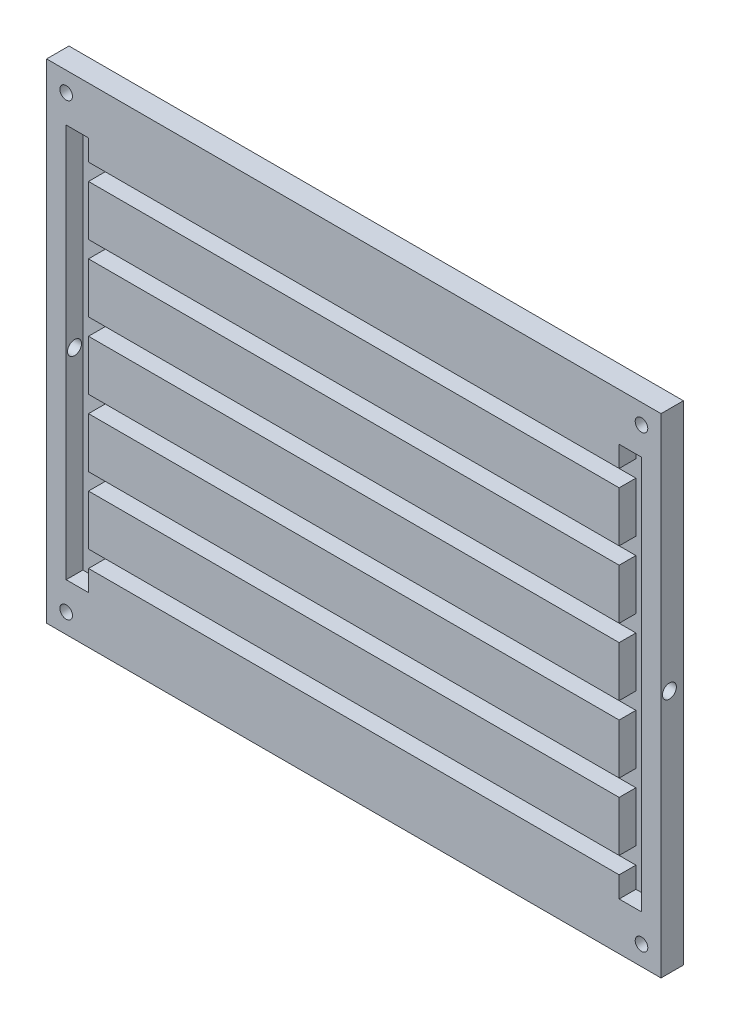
SolidWorks part; units mm, degrees
ref_plane "Front Plane" through (0, 0, 0) normal (0, 0, 1) x (1, 0, 0)
ref_plane "Top Plane" through (0, 0, 0) normal (0, 1, 0) x (1, 0, 0)
ref_plane "Right Plane" through (0, 0, 0) normal (1, 0, 0) x (0, 0, -1)
sketch "Sketch1" plane through (0, 0, 0) normal (0, 0, 1) x (1, 0, 0)
  line L1 (0, 0) -> (220, 0)
  line L2 (0, 0) -> (0, 175)
  line L3 (0, 175) -> (220, 175)
  line L4 (220, 0) -> (220, 175)
  dimension "D1" = 220
  dimension "D2" = 175
extrude "Boss-Extrude1" add sketch "Sketch1" along normal blind 8
sketch "Sketch2" plane through (0, 0, 8) normal (0, 0, 1) x (1, 0, 0)
  line L0 (15, 54.5) -> (15, 48.5)
  line L1 (15, 30.5) -> (205, 30.5)
  line L2 (15, 30.5) -> (15, 24.5)
  line L3 (15, 24.5) -> (205, 24.5)
  line L4 (205, 30.5) -> (205, 24.5)
  line L5 (15, 54.5) -> (205, 54.5)
  line L6 (205, 54.5) -> (205, 48.5)
  line L7 (15, 48.5) -> (205, 48.5)
  line L8 (15, 78.5) -> (15, 72.5)
  line L9 (15, 78.5) -> (205, 78.5)
  line L10 (205, 78.5) -> (205, 72.5)
  line L11 (15, 72.5) -> (205, 72.5)
  line L12 (15, 102.5) -> (15, 96.5)
  line L13 (15, 102.5) -> (205, 102.5)
  line L14 (205, 102.5) -> (205, 96.5)
  line L15 (15, 96.5) -> (205, 96.5)
  line L16 (15, 126.5) -> (15, 120.5)
  line L17 (15, 126.5) -> (205, 126.5)
  line L18 (205, 126.5) -> (205, 120.5)
  line L19 (15, 120.5) -> (205, 120.5)
  line L20 (15, 150.5) -> (15, 144.5)
  line L21 (15, 150.5) -> (205, 150.5)
  line L22 (205, 150.5) -> (205, 144.5)
  line L23 (15, 144.5) -> (205, 144.5)
  dimension "D1" = 6
extrude "Cut-Extrude1" cut sketch "Sketch2" against normal blind 6
sketch "Sketch3" plane through (0, 0, 8) normal (0, 0, 1) x (1, 0, 0)
  line L1 (7, 17) -> (15, 17)
  line L2 (7, 17) -> (7, 158)
  line L3 (7, 158) -> (15, 158)
  line L4 (15, 17) -> (15, 158)
  line L5 (205, 17) -> (213, 17)
  line L6 (205, 17) -> (205, 158)
  line L7 (205, 158) -> (213, 158)
  line L8 (213, 17) -> (213, 158)
extrude "Cut-Extrude2" cut sketch "Sketch3" against normal blind 6
sketch "Sketch5" plane through (0, 0, 0) normal (-1, 0, 0) x (0, 0, 1)
  line L0 (0, 175) -> (0, 0) construction
  line L1 (8, 0) -> (0, 0) construction
  circle A0 centre (5, 87.4943) radius 2.5
  point P6 (4, 0)
  dimension "D1" = 5
  dimension "D2" = 5
  dimension "D3" = 87.5
extrude "Cut-Extrude3" cut sketch "Sketch5" against normal blind 7
sketch "Sketch6" plane through (220, 0, 0) normal (1, 0, 0) x (0, 0, -1)
  line L1 (-8, 0) -> (0, 0) construction
  line L2 (0, 0) -> (0, 175) construction
  circle A0 centre (-5, 87.5) radius 2.5
  dimension "D1" = 5
  dimension "D2" = 5
  dimension "D3" = 87.5
extrude "Cut-Extrude4" cut sketch "Sketch6" against normal blind 7
sketch "Sketch7" plane through (0, 0, 8) normal (0, 0, 1) x (1, 0, 0)
  line L1 (7, 7) -> (213, 7) construction
  line L2 (7, 7) -> (7, 168) construction
  line L3 (7, 168) -> (213, 168) construction
  line L4 (213, 7) -> (213, 168) construction
  circle A0 centre (213, 168) radius 2.25
  circle A1 centre (7, 168) radius 2.25
  circle A2 centre (7, 7) radius 2.25
  circle A3 centre (213, 7) radius 2.25
  dimension "D1" = 4.5
extrude "Cut-Extrude5" cut sketch "Sketch7" against normal through all
